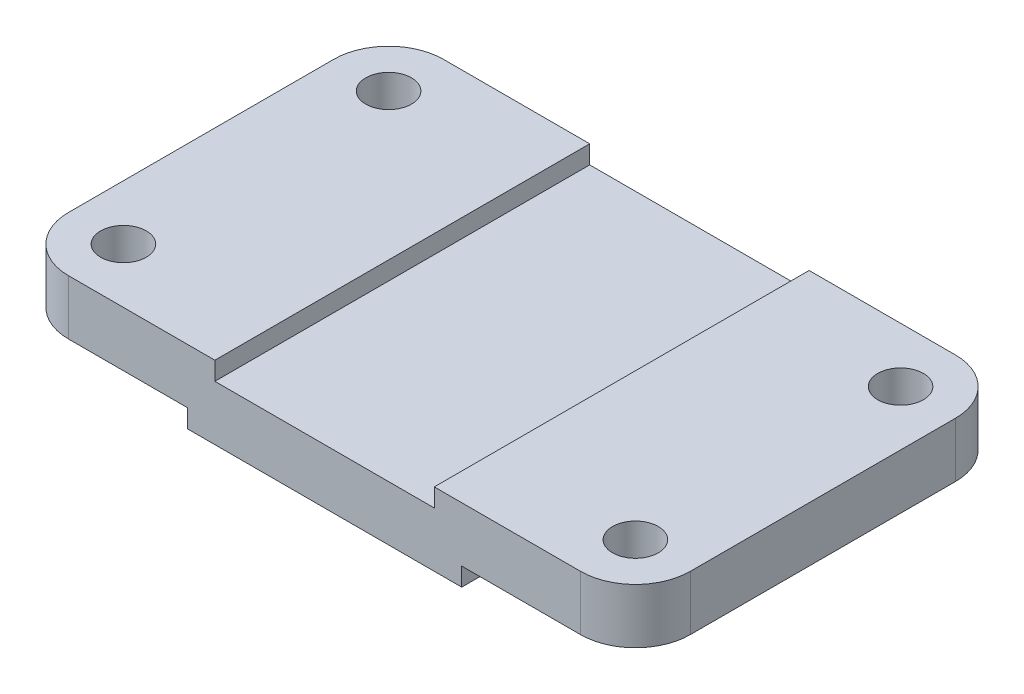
SolidWorks part; units mm, degrees
ref_plane "前基準面" through (0, 0, 0) normal (0, 0, 1) x (1, 0, 0)
ref_plane "上基準面" through (0, 0, 0) normal (0, 1, 0) x (1, 0, 0)
ref_plane "右基準面" through (0, 0, 0) normal (1, 0, 0) x (0, 0, -1)
sketch "草圖1" plane through (0, 0, 0) normal (0, 0, 1) x (1, 0, 0)
  line L0 (0, 0) -> (0, 42.2908) construction
  line L1 (-30, 0) -> (30, 0)
  line L2 (30, 0) -> (30, 4)
  line L3 (-30, 0) -> (-30, 4)
  line L4 (30, 4) -> (68, 4)
  line L5 (-30, 4) -> (-68, 4)
  line L6 (68, 4) -> (68, 16)
  line L7 (-68, 4) -> (-68, 16)
  line L8 (68, 16) -> (24, 16)
  line L9 (24, 16) -> (24, 12)
  line L10 (-24, 16) -> (-24, 12)
  line L11 (24, 12) -> (-24, 12)
  line L12 (-24, 16) -> (-68, 16)
  point P17 (0, 12)
  dimension "D1" = 60
  dimension "D2" = 44
  dimension "D3" = 136
  dimension "D4" = 4
  dimension "D5" = 16
  dimension "D6" = 4
extrude "伸長1" add sketch "草圖1" along normal mid plane 82
fillet "圓角1" radius 12 4 edges at (68, 10, 41) (68, 10, -41) (-68, 10, -41) (-68, 10, 41)
sketch "草圖2" plane through (0, 16, 0) normal (0, 1, 0) x (-1, 0, 0)
  circle A0 centre (-56, -29) radius 5
  arc A1 (-68, -29) -> (-56, -41) centre (-56, -29) ccw construction
  circle A2 centre (-56, 29) radius 5
  arc A3 (-56, 41) -> (-68, 29) centre (-56, 29) ccw construction
  circle A4 centre (56, -29) radius 5
  arc A5 (56, -41) -> (68, -29) centre (56, -29) ccw construction
  circle A6 centre (56, 29) radius 5
  arc A7 (68, 29) -> (56, 41) centre (56, 29) ccw construction
  dimension "D1" = 10
extrude "除料-伸長1" cut sketch "草圖2" against normal through all
